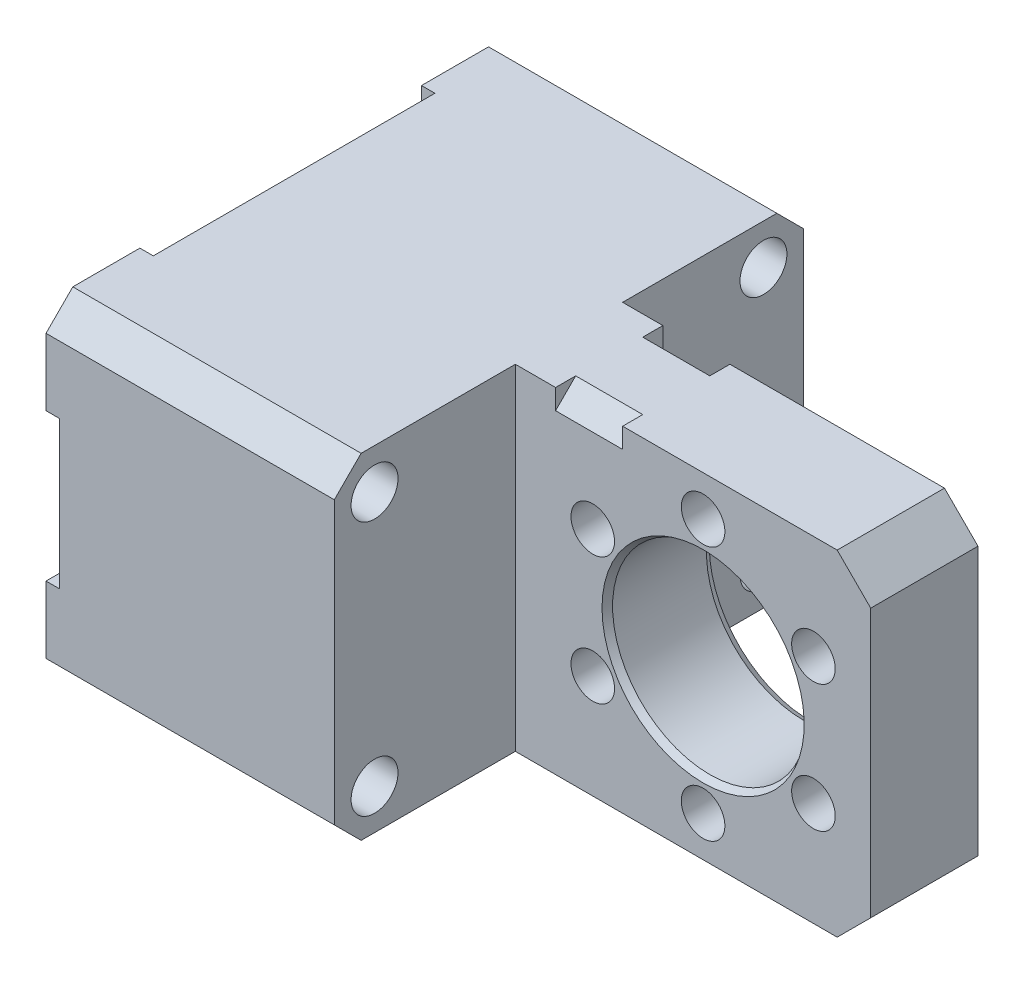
SolidWorks part; units mm, degrees
ref_plane "Plan1" through (0, 0, 0) normal (0, 0, 1) x (1, 0, 0)
ref_plane "Plan2" through (0, 0, 0) normal (0, 1, 0) x (1, 0, 0)
ref_plane "Plan3" through (0, 0, 0) normal (1, 0, 0) x (0, 0, -1)
sketch "Esquisse1" plane through (0, 0, 0) normal (0, 1, 0) x (1, 0, 0)
  line L0 (-50, 0) -> (50, 0) construction
  line L1 (0, 0) -> (43, 0)
  line L2 (0, 0) -> (0, -70)
  line L3 (0, -70) -> (43, -70)
  line L4 (96, -27) -> (96, -43)
  line L6 (0, -50) -> (0, 50) construction
  line L7 (43, -70) -> (43, -43)
  line L8 (43, -43) -> (96, -43)
  line L9 (96, -27) -> (43, -27)
  line L10 (43, -27) -> (43, 0)
  dimension "D1" = 70
  dimension "D3" = 27
  dimension "D4" = 43
  dimension "D2" = 96
  dimension "D5" = 16
  dimension "D6" = 27
extrude "Boss.-Extru.1" add sketch "Esquisse1" along normal mid plane 50
hole_wizard "Diamètre du perçage Ø7.0 (7)1" positions "Esquisse2" profile "Esquisse3" hole size "Ø7.0" standard "ISO"
sketch "Esquisse2" plane through (43, 0, 0) normal (1, 0, 0) x (0, 0, -1)
  line L0 (-69.4126, 0) -> (10.1824, 0) construction
  line L2 (50, 0) -> (-50, 0) construction
  line L3 (0, 25) -> (0, -25) construction
  line L4 (-70, 25) -> (-70, -25) construction
  point P0 (-64, 19)
  point P2 (-6, 19)
  point P13 (-6, -19)
  point P14 (-64, -19)
  dimension "D1" = 38
  dimension "D2" = 6
  dimension "D3" = 6
  dimension "D4" = 58
sketch "Esquisse3" plane through (43, 19, 64) normal (0, 1, 0) x (0, 0, -1)
  line L0 (0, 0) -> (0, 43)
  line L1 (0, 43) -> (3.5, 43)
  line L2 (3.5, 43) -> (3.5, 0)
  line L5 (3.5, 0) -> (0, 0)
  line L11 (0, -6.35) -> (0, 107.95) construction
  dimension "Diamètre du perçage jusqu'au prochain" = 7
  dimension "Profondeur du perçage jusqu'au prochain" = 43
sketch "Esquisse4" plane through (0, 0, 27) normal (0, 0, -1) x (-1, 0, 0)
  line L0 (50, 0) -> (-50, 0) construction
  line L1 (0, 50) -> (0, -50) construction
  circle A0 centre (-71, 0) radius 14.5
  dimension "D2" = 29
  dimension "D1" = 71
extrude "Enlèv. mat.-Extru.1" cut sketch "Esquisse4" against normal blind 30
sketch "Esquisse5" plane through (0, 0, 27) normal (0, 0, -1) x (-1, 0, 0)
  circle A0 centre (-71, 0) radius 19 construction
  circle A1 centre (-71, -19) radius 3.25
  dimension "D1" = 38
  dimension "D2" = 6.5
extrude "Enlèv. mat.-Extru.2" cut sketch "Esquisse5" against normal blind 30
pattern_circular "Répétition circulaire1" count 6 over 360 about axis through (71, 0, 0) along (0, 0, 1) of "Enlèv. mat.-Extru.2"
chamfer "Chanfrein1" distance 4 angle 45 4 edges at (21.5, 25, 70) (21.5, 25, 0) (21.5, -25, 0) (21.5, -25, 70)
chamfer "Chanfrein2" distance 5 angle 45 2 edges at (96, -25, 35) (96, 25, 35)
sketch "Esquisse6" plane through (0, 0, 0) normal (-1, 0, 0) x (0, 0, 1)
  line L0 (4, 25) -> (66, 25) construction
  line L1 (56, 25) -> (70, 25)
  line L2 (56, 25) -> (56, 19)
  line L3 (64, 11) -> (70, 11)
  line L4 (70, 25) -> (70, 11)
  line L5 (70, 21) -> (70, -21) construction
  line L6 (4, -25) -> (66, -25) construction
  line L7 (0, 25) -> (14, 25)
  line L8 (0, 25) -> (0, 11)
  line L9 (0, 11) -> (6, 11)
  line L10 (14, 25) -> (14, 19)
  line L11 (0, -11) -> (6, -11)
  line L12 (0, -11) -> (0, -25)
  line L13 (0, -25) -> (14, -25)
  line L14 (14, -19) -> (14, -25)
  line L15 (64, -11) -> (70, -11)
  line L16 (56, -19) -> (56, -25)
  line L17 (56, -25) -> (70, -25)
  line L18 (70, -11) -> (70, -25)
  line L19 (0, 21) -> (0, -21) construction
  arc A0 (64, 11) -> (56, 19) centre (64, 19) cw
  circle A1 centre (64, 19) radius 3.5 construction
  arc A2 (14, -19) -> (6, -11) centre (6, -19) ccw
  arc A3 (14, 19) -> (6, 11) centre (6, 19) cw
  arc A4 (56, -19) -> (64, -11) centre (64, -19) cw
  circle A5 centre (6, 19) radius 3.5 construction
  circle A6 centre (6, -19) radius 3.5 construction
  circle A7 centre (64, -19) radius 3.5 construction
  dimension "D1" = 8
extrude "Enlèv. mat.-Extru.3" cut sketch "Esquisse6" against normal blind 2 flip side to cut
sketch "Esquisse7" plane through (43, 0, 0) normal (1, 0, 0) x (0, 0, -1)
  line L0 (-43, 22) -> (-43, 25)
  line L1 (-43, 25) -> (-40, 25)
  line L2 (-40, 25) -> (-43, 22)
  line L3 (-30, 25) -> (-27, 25)
  line L4 (-27, 25) -> (-27, 22)
  line L5 (-27, 22) -> (-30, 25)
  line L6 (-66, 25) -> (-43, 25) construction
  line L7 (-43, 25) -> (-43, -25) construction
  line L8 (-27, 25) -> (-27, -25) construction
  dimension "D1" = 3
  dimension "D2" = 45
extrude "Enlèv. mat.-Extru.4" cut sketch "Esquisse7" along normal blind 10 from offset 6
chamfer "Chanfrein3" distance 1 angle 30 2 edges at (56.5, 0, 27) (56.5, 0, 43)
